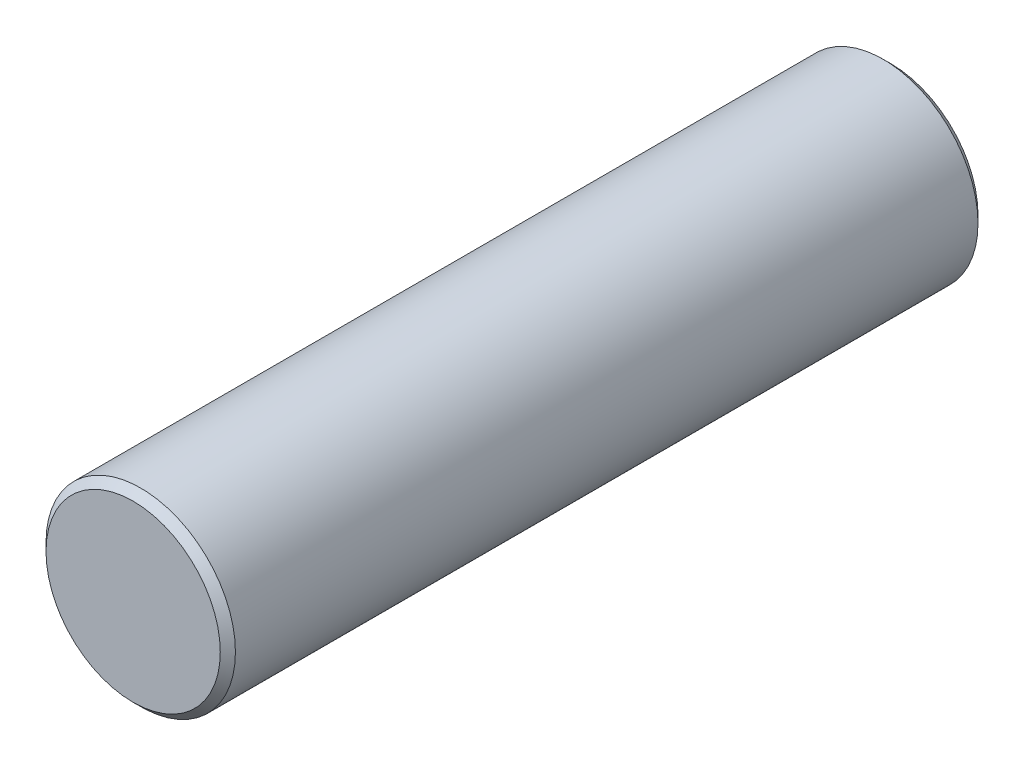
SolidWorks part; units mm, degrees
ref_plane "Front Plane" through (0, 0, 0) normal (0, 0, 1) x (1, 0, 0)
ref_plane "Top Plane" through (0, 0, 0) normal (0, 1, 0) x (1, 0, 0)
ref_plane "Right Plane" through (0, 0, 0) normal (1, 0, 0) x (0, 0, -1)
sketch "Sketch1" plane through (0, 0, 0) normal (0, 0, 1) x (1, 0, 0)
  circle A0 centre (0, 0) radius 3.175
  dimension "D1" = 6.35
extrude "Boss-Extrude1" add sketch "Sketch1" along normal blind 25.4
chamfer "Chamfer1" distance 0.254 angle 45 2 edges at (3.175, 0, 0) (3.175, 0, 25.4)
